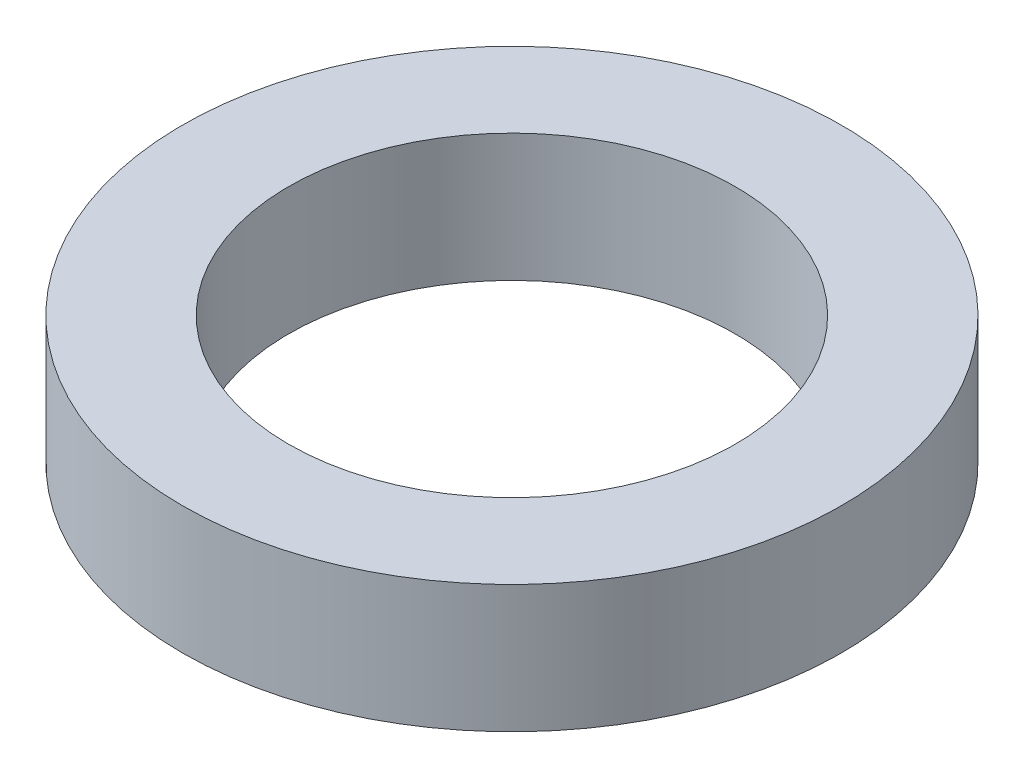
SolidWorks part; units mm, degrees
ref_plane "Front Plane" through (0, 0, 0) normal (0, 0, 1) x (1, 0, 0)
ref_plane "Top Plane" through (0, 0, 0) normal (0, 1, 0) x (1, 0, 0)
ref_plane "Right Plane" through (0, 0, 0) normal (1, 0, 0) x (0, 0, -1)
sketch "Sketch1" plane through (0, 0, 0) normal (0, 1, 0) x (1, 0, 0)
  circle A0 centre (0, 0) radius 21
  circle A1 centre (0, 0) radius 31
  dimension "D1" = 42
  dimension "D2" = 62
extrude "Boss-Extrude1" add sketch "Sketch1" along normal blind 12
